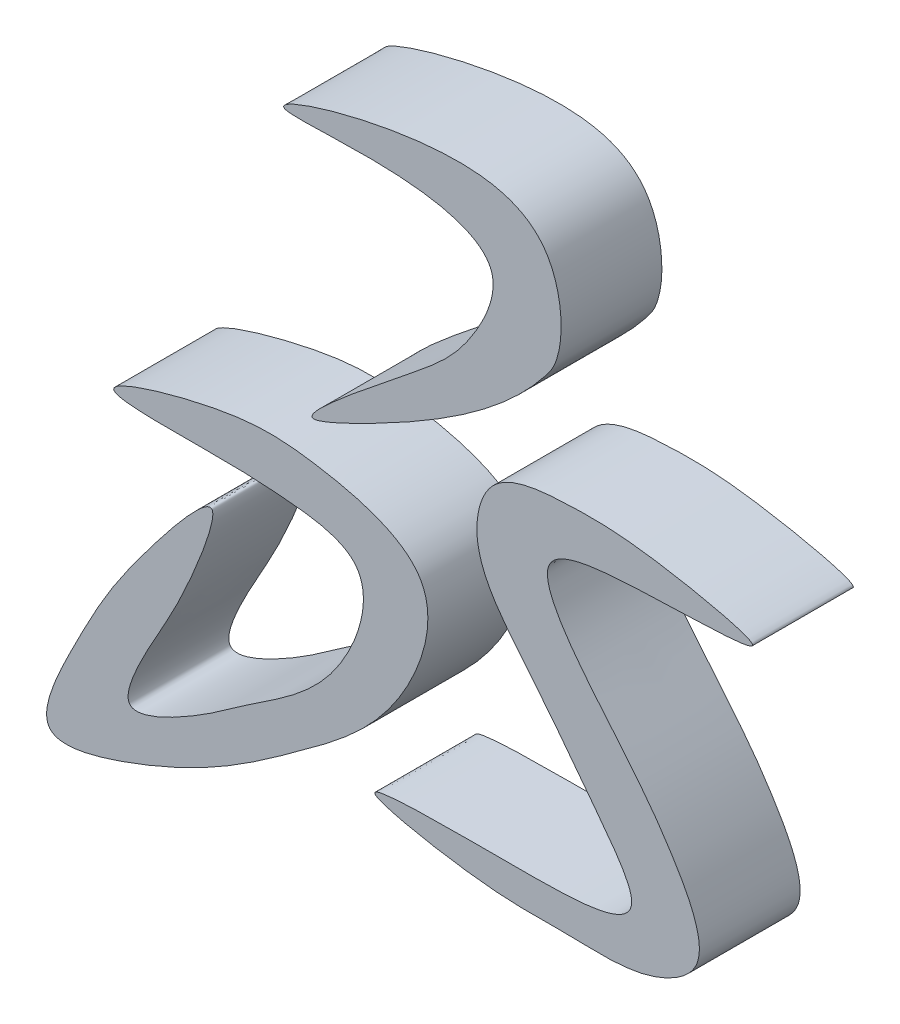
SolidWorks part; units mm, degrees
ref_plane "Front Plane" through (0, 0, 0) normal (0, 0, 1) x (1, 0, 0)
ref_plane "Top Plane" through (0, 0, 0) normal (0, 1, 0) x (1, 0, 0)
ref_plane "Right Plane" through (0, 0, 0) normal (1, 0, 0) x (0, 0, -1)
sketch "Sketch1" plane through (0, 0, 0) normal (0, 0, 1) x (1, 0, 0)
  point P0 (-41.1482, 72.3818)
  point P1 (-35.8654, 73.5956)
  point P2 (-27.2032, 65.5216)
  point P3 (-33.2867, 72.4635)
  point P4 (-30.1522, 66.2427)
  point P5 (-33.2636, 69.4982)
  point P6 (-46.2111, 62.5617)
  point P7 (-38.6009, 65.5216)
  point P8 (-34.9543, 65.7242)
  point P9 (-40.2591, 64.8054)
  point P10 (-42.867, 63.6629)
  point P11 (-37.5146, 67.318)
  point P12 (-35.4021, 64.2335)
  point P13 (-35.6147, 69.2076)
  point P14 (-34.0086, 61.6734)
  point P15 (-34.9543, 71.1889)
  point P16 (-31.7401, 58.7568)
  point P17 (-37.3214, 72.3045)
  point P18 (-34.4299, 56.2615)
  point P19 (-30.8003, 57.1041)
  point P20 (-32.6475, 55.2893)
  point P21 (-38.4432, 56.0475)
  point P22 (-29.5365, 58.7892)
  point P23 (-34.7539, 55.3217)
  point P24 (-32.8095, 66.3723)
  point P25 (-30.1522, 55.4837)
  point P27 (-28.8883, 56.3911)
  point P28 (-40.2591, 63.6629)
  point P29 (-31.7077, 61.641)
  point P31 (-33.2636, 64.5252)
  point P32 (-37.0758, 62.2355)
  point P33 (-30.6383, 65.2381)
  point P35 (-37.8099, 58.7568)
  point P37 (-40.6647, 56.0475)
  point P39 (-45.681, 53.2225)
  point P41 (-48.1279, 52.8963)
  point P43 (-47.4346, 55.3217)
  point P45 (-45.3547, 58.7568)
  point P47 (-43.3156, 60.9712)
  point P49 (-44.3351, 57.9941)
  point P51 (-45.2731, 56.2615)
  point P53 (-45.7625, 54.7315)
  point P55 (-43.6418, 55.4837)
  point P57 (-42.296, 56.4036)
  point P59 (-39.5636, 58.7568)
  point P61 (-39.0334, 61.6734)
  point P63 (-41.1133, 62.3171)
  point P65 (-43.5195, 62.3986)
extrude "Extrude1" add sketch "Sketch1" along normal blind 3
